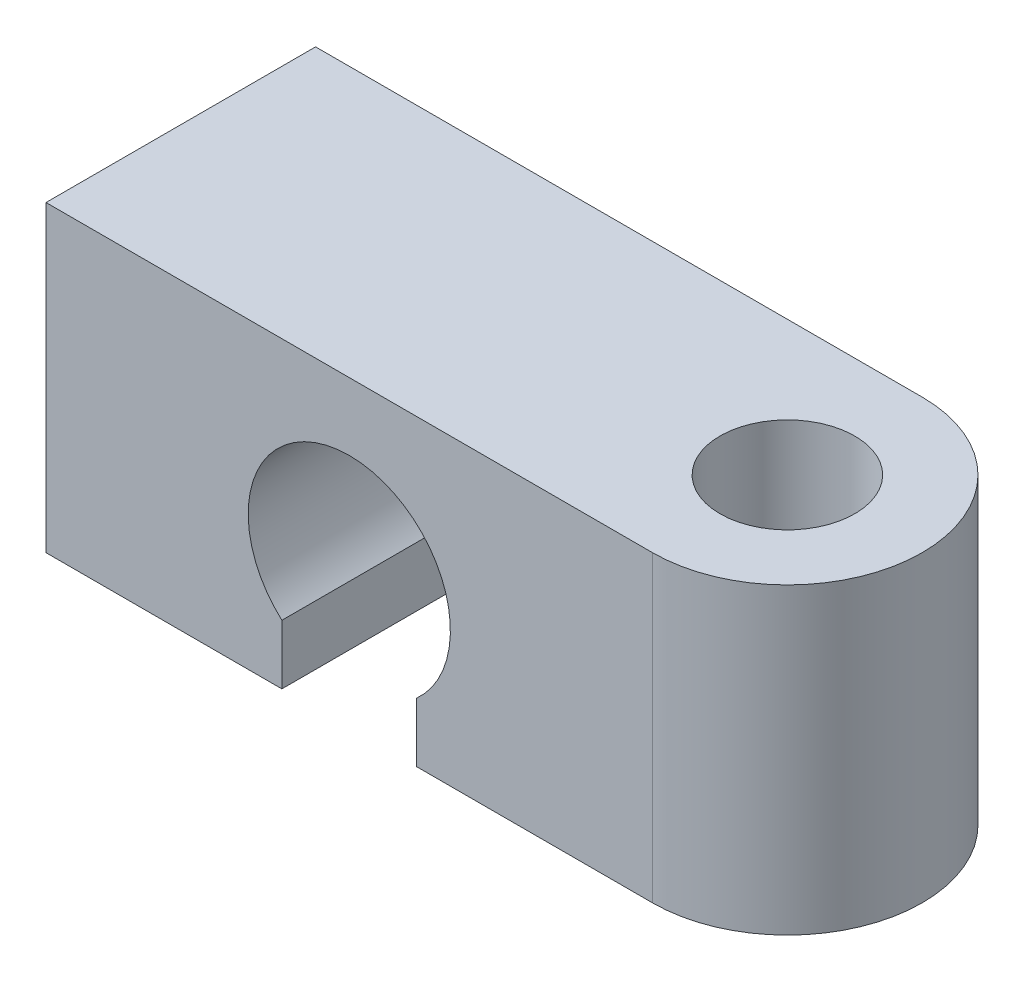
SolidWorks part; units mm, degrees
ref_plane "Front Plane" through (0, 0, 0) normal (0, 0, 1) x (1, 0, 0)
ref_plane "Top Plane" through (0, 0, 0) normal (0, 1, 0) x (1, 0, 0)
ref_plane "Right Plane" through (0, 0, 0) normal (1, 0, 0) x (0, 0, -1)
sketch "Sketch1" plane through (0, 0, 0) normal (0, 0, 1) x (1, 0, 0)
  line L0 (-1, -1.118) -> (-1, -2)
  line L1 (-4.5, 2.5) -> (4.5, 2.5)
  line L2 (-4.5, 2.5) -> (-4.5, -2)
  line L3 (-4.5, -2) -> (-1, -2)
  line L4 (4.5, 2.5) -> (4.5, -2)
  line L5 (1, -1.118) -> (1, -2)
  line L6 (0, 0) -> (0, 2.5) construction
  line L7 (1, -2) -> (4.5, -2)
  arc A0 (1, -1.118) -> (-1, -1.118) centre (0, 0) ccw
  dimension "ROU_DIAM" = 3
  dimension "D2" = 0.5
  dimension "D3" = 2
  dimension "D4" = 1
  dimension "D5" = 4.5
extrude "Boss-Extrude1" add sketch "Sketch1" along normal mid plane 4
sketch "Sketch2" plane through (0, 2.5, 0) normal (0, 1, 0) x (1, 0, 0)
  line L0 (4.5, -2) -> (4.5, 2) construction
  line L1 (4.5, -2) -> (4.5, 2)
  arc A0 (4.5, -2) -> (4.5, 2) centre (4.5, 0) ccw
extrude "Boss-Extrude2" add sketch "Sketch2" against normal up to surface (4.5 mm away)
hole_wizard "Ø2.0 (2) Diameter Hole1" positions "Sketch4" profile "Sketch3" hole size "Ø2.0" standard "Ansi Metric"
sketch "Sketch4" plane through (-9, 2.5, 2) normal (0, 1, 0) x (-1, 0, 0)
  point P0 (-13.5, -2)
sketch "Sketch3" plane through (4.5, 2.5, 0) normal (1, 0, 0) x (0, 0, 1)
  line L0 (0, 0) -> (0, 4.5)
  line L1 (0, 4.5) -> (1, 4.5)
  line L2 (1, 4.5) -> (1, 0)
  line L5 (1, 0) -> (0, 0)
  line L11 (0, -6.35) -> (0, 107.95) construction
  dimension "Thru Hole Dia." = 2
  dimension "Thru Hole Depth" = 4.5
sketch "FilterSketch" plane through (0, 0, 0) normal (1, 0, 0) x (0, 0, -1)
  circle A0 centre (0, 0) radius 1.5
  circle A1 centre (0, 0) radius 0.5
  dimension "OuterDiameter" = 3
  dimension "NominalDiameter" = 3
  dimension "InnerDiameter" = 1
sketch "Sketch5" plane through (0, 0, 2) normal (0, 0, 1) x (1, 0, 0)
  point P0 (0, 0)
sketch "Sketch6" plane through (0, 0, -2) normal (0, 0, -1) x (-1, 0, 0)
  point P0 (0, 0)
